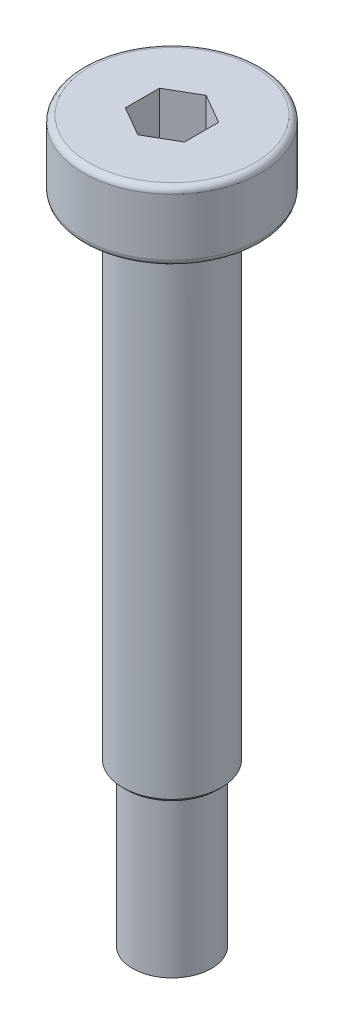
SolidWorks part; units mm, degrees
ref_plane "前视基准面" through (0, 0, 0) normal (0, 0, 1) x (1, 0, 0)
ref_plane "上视基准面" through (0, 0, 0) normal (0, 1, 0) x (1, 0, 0)
ref_plane "右视基准面" through (0, 0, 0) normal (1, 0, 0) x (0, 0, -1)
sketch "草图1" plane through (0, 0, 0) normal (0, 0, 1) x (1, 0, 0)
  line L0 (0, 0) -> (0, -15.0528) construction
  line L1 (0, 0) -> (0, 3.5) construction
  line L2 (0, 3.5) -> (-4.5, 3.5)
  line L3 (-4.5, 3.5) -> (-4.5, 0)
  line L4 (-4.5, 0) -> (-2.5, 0)
  line L5 (-2.5, 0) -> (-2.5, -25)
  line L6 (-2.5, -25) -> (-2, -25)
  line L7 (-2, -25) -> (-2, -33)
  line L8 (-2, -33) -> (0, -33)
  line L9 (0, 3.5) -> (0, -33)
  dimension "D1" = 9
  dimension "D2" = 5
  dimension "D3" = 3.5
  dimension "D4" = 25
  dimension "D5" = 8
  dimension "D6" = 4
revolve "旋转1" add sketch "草图1" angle 360 about L9
fillet "圆角1" radius 0.3 2 edges at (-4.5, 0, 0) (-4.5, 3.5, 0)
sketch "草图2" plane through (0, 3.5, 0) normal (0, 1, 0) x (1, 0, 0)
  line L1 (0, 1.7321) -> (-1.5, 0.866)
  line L2 (-1.5, 0.866) -> (-1.5, -0.866)
  line L3 (-1.5, -0.866) -> (0, -1.7321)
  line L4 (0, -1.7321) -> (1.5, -0.866)
  line L5 (1.5, -0.866) -> (1.5, 0.866)
  line L6 (1.5, 0.866) -> (0, 1.7321)
  circle A0 centre (0, 0) radius 1.5 construction
  dimension "D1" = 3
extrude "切除-拉伸1" cut sketch "草图2" against normal blind 2.4
chamfer "倒角1" distance 0.2 angle 45 1 edges at (-2.5, -25, 0)
